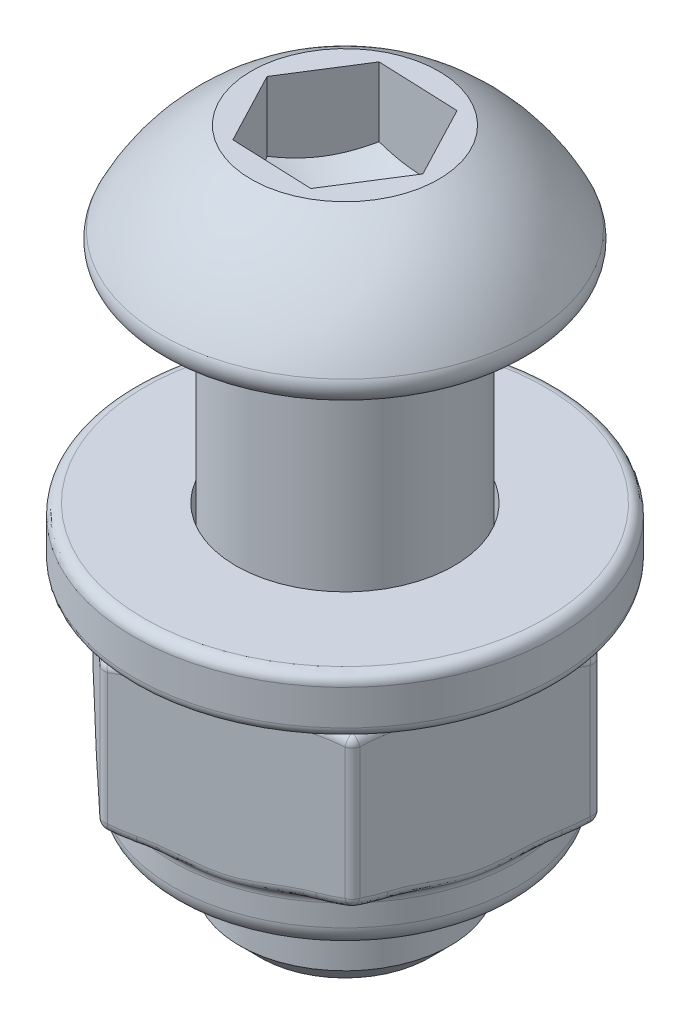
SolidWorks part; units mm, degrees
ref_plane "Plan de face" through (0, 0, 0) normal (0, 0, 1) x (1, 0, 0)
ref_plane "Plan de dessus" through (0, 0, 0) normal (0, 1, 0) x (1, 0, 0)
ref_plane "Plan de droite" through (0, 0, 0) normal (1, 0, 0) x (0, 0, -1)
sketch "Esquisse1" plane through (0, 0, 0) normal (0, 0, 1) x (1, 0, 0)
  line L0 (0, 0) -> (0, -16)
  line L1 (0, -16) -> (-2.4, -16)
  line L2 (-2.4, -16) -> (-3, -15.4)
  line L3 (-3, -15.4) -> (-3, 0)
  line L4 (-2.5, 3.3) -> (-2.6658, 3.3)
  line L6 (-2.5, 3.3) -> (-2.5, 1.4434)
  line L7 (-2.5, 1.4434) -> (0, 0)
  line L8 (-4.75, 0) -> (-3, 0)
  arc A0 (-2.6658, 3.3) -> (-5.1981, 0.7218) centre (0, -1.8511) ccw
  arc A1 (-5.1981, 0.7218) -> (-4.75, 0) centre (-4.75, 0.5) ccw
  dimension "D5" = 3.3
  dimension "D7" = 5.8
  dimension "D3" = 0.5
  dimension "D1" = 60
  dimension "D2" = 3
  dimension "D4" = 2.5
  dimension "D6" = 4.75
  dimension "D8" = 45
  dimension "D9" = 0.6
  dimension "D10" = 3.3
  dimension "D11" = 16
revolve "Révolution1" add sketch "Esquisse1" angle 360 about L0
sketch "Esquisse2" plane through (0, 3.3, 0) normal (0, 1, 0) x (1, 0, 0)
  line L1 (-1.0737, 2.0446) -> (-2.3075, 0.0925)
  line L2 (-2.3075, 0.0925) -> (-1.2339, -1.9521)
  line L3 (-1.2339, -1.9521) -> (1.0737, -2.0446)
  line L4 (1.0737, -2.0446) -> (2.3075, -0.0925)
  line L5 (2.3075, -0.0925) -> (1.2339, 1.9521)
  line L6 (1.2339, 1.9521) -> (-1.0737, 2.0446)
  circle A0 centre (0, 0) radius 2 construction
  circle A1 centre (0, 0) radius 2.6658 construction
  circle A2 centre (0, 0) radius 2.6658
  dimension "D2" = 4
extrude "Boss.-Extru.1" add sketch "Esquisse2" against normal up to surface (3.3 mm away)
sketch "Esquisse4" plane through (0, 0, 0) normal (0, 0, 1) x (1, 0, 0)
  line L0 (0, 0) -> (0, -18.2878) construction
  line L1 (3.1, -6) -> (5.7, -6)
  line L2 (3.1, -6) -> (3.1, -7.6)
  line L3 (3.1, -7.6) -> (5.7, -7.6)
  line L4 (6, -6.3) -> (6, -7.3)
  arc A0 (5.7, -7.6) -> (6, -7.3) centre (5.7, -7.3) ccw
  arc A1 (5.7, -6) -> (6, -6.3) centre (5.7, -6.3) cw
  dimension "D4" = 0.3
  dimension "D1" = 3.1
  dimension "D2" = 1.6
  dimension "D3" = 6
  dimension "D5" = 6
revolve "Révolution2" add sketch "Esquisse4" angle 360 about L0
sketch "Esquisse3" plane through (0, 0, 0) normal (0, 0, 1) x (1, 0, 0)
  line L0 (3, -15.4) -> (3, 0) construction
  line L1 (3.25, -7.6) -> (5, -7.6)
  line L2 (3, -7.85) -> (3, -13.4)
  line L3 (0, 0) -> (0, -17.1274) construction
  line L4 (5, -7.6) -> (5, -12.1) construction
  line L5 (3.9, -13.6) -> (3.9, -13.4)
  line L6 (3, -7.85) -> (3.25, -7.6)
  line L7 (4.9, -12.3879) -> (4.9, -13)
  line L8 (4.3, -13.6) -> (3.9, -13.6)
  line L9 (-5.7, -7.6) -> (5.7, -7.6) construction
  line L10 (3.9, -13.4) -> (3, -13.4)
  line L11 (6.75, -9.85) -> (5, -9.85) construction
  line L12 (5, -9.85) -> (3.25, -9.85) construction
  arc A0 (4.9, -12.3879) -> (5.164, -12.0901) centre (5.2, -12.3879) cw
  arc A1 (4.9, -13) -> (4.3, -13.6) centre (4.3, -13) cw
  ellipse E0 centre (5, -9.85) end of major axis (5, -7.6) minor radius 1.75 (5.164, -12.0901) -> (5, -7.6) ccw
  point P0 (3, -7.6)
  point P15 (4.9, -13.6)
  dimension "D6" = 0.6
  dimension "D7" = 1.9
  dimension "D8" = 0.3
  dimension "D1" = 4.5
  dimension "D2" = 6
  dimension "D3" = 5
  dimension "D4" = 5.8
  dimension "D5" = 0.9
  dimension "D10" = 1.75
revolve "Révolution3" add sketch "Esquisse3" angle 360 about L3
sketch "Esquisse5" plane through (0, -6, 0) normal (0, 1, 0) x (1, 0, 0)
  line L1 (-5.5357, -1.6398) -> (-1.3478, -5.614)
  line L2 (-1.3478, -5.614) -> (4.188, -3.9742)
  line L3 (4.188, -3.9742) -> (5.5357, 1.6398)
  line L4 (5.5357, 1.6398) -> (1.3478, 5.614)
  line L5 (1.3478, 5.614) -> (-4.188, 3.9742)
  line L6 (-4.188, 3.9742) -> (-5.5357, -1.6398)
  circle A0 centre (0, 0) radius 5 construction
  circle A1 centre (0, 0) radius 9.7979
  dimension "D1" = 10
extrude "Enlèv. mat.-Extru.1" cut sketch "Esquisse5" against normal blind 10
fillet "Congé1" radius 0.5 1 edges at (0, -13.6, 3.9)
fillet "Congé2" radius 0.3 36 edges at (3.9485, -12.129, -3.146) (5.5357, -9.85, -1.6398) (4.6988, -12.129, 1.8465) (4.188, -9.85, 3.9742) (0.7503, -12.129, 4.9925) (-1.3478, -9.85, 5.614) (-3.9485, -12.129, 3.146) (-5.5357, -9.85, 1.6398) (-4.6988, -12.129, -1.8465) (-4.188, -9.85, -3.9742) (-0.7503, -12.129, -4.9925) (1.3478, -9.85, -5.614)
